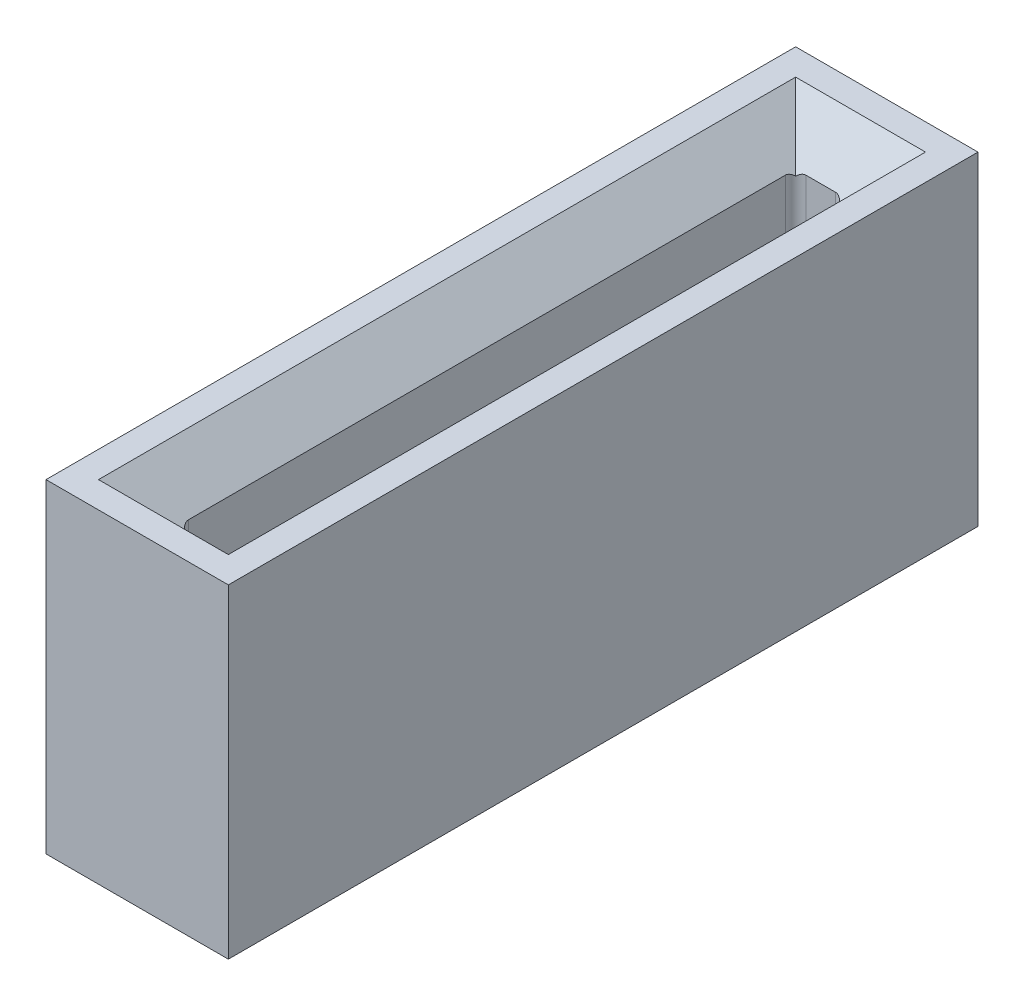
SolidWorks part; units mm, degrees
ref_plane "Front Plane" through (0, 0, 0) normal (1, 0, 0) x (0, 1, 0)
ref_plane "Top Plane" through (0, 0, 0) normal (0, 0, 1) x (0, 1, 0)
ref_plane "Right Plane" through (0, 0, 0) normal (0, 1, 0) x (-1, 0, 0)
sketch "sk 30x2in w weld" plane through (0, 0, 0) normal (0, 1, 0) x (-1, 0, 0)
  line L0 (-92.075, 447.675) -> (92.075, 447.675)
  line L1 (-25.4, 381) -> (25.4, 381)
  line L2 (-25.4, 381) -> (-25.4, -381)
  line L3 (-25.4, -381) -> (25.4, -381)
  line L4 (25.4, 381) -> (25.4, -381)
  line L5 (-25.4, 381) -> (25.4, -381) construction
  line L6 (-25.4, -381) -> (25.4, 381) construction
  line L7 (92.075, 447.675) -> (92.075, -447.675)
  line L8 (-92.075, -447.675) -> (92.075, -447.675)
  line L9 (-92.075, 447.675) -> (-92.075, -447.675)
  point P0 (0, 0)
  dimension "D1" = 50.8
  dimension "D2" = 762
  dimension "D3" = 66.675
sketch "sk block" plane through (0, 0, 0) normal (0, 1, 0) x (-1, 0, 0)
  line L8 (-31.4, 387) -> (-31.4, -387)
  line L9 (-31.4, -387) -> (31.4, -387)
  line L10 (31.4, -387) -> (31.4, 387)
  line L11 (31.4, 387) -> (-31.4, 387)
  line L12 (-31.4, 387) -> (-31.4, -387)
  line L13 (-31.4, -387) -> (31.4, -387)
  line L14 (31.4, -387) -> (31.4, 387)
  line L15 (31.4, 387) -> (-31.4, 387)
  line L20 (-114.3, 469.9) -> (-114.3, -469.9)
  line L21 (-114.3, -469.9) -> (114.3, -469.9)
  line L22 (114.3, -469.9) -> (114.3, 469.9)
  line L23 (114.3, 469.9) -> (-114.3, 469.9)
  line L24 (-114.3, 469.9) -> (-114.3, -469.9)
  line L25 (-114.3, -469.9) -> (114.3, -469.9)
  line L26 (114.3, -469.9) -> (114.3, 469.9)
  line L27 (114.3, 469.9) -> (-114.3, 469.9)
  dimension "D1" = 6
  dimension "D2" = 88.9
sketch "sk Holes" plane through (0, 0, 0) normal (0, 1, 0) x (-1, 0, 0)
  line L0 (-25.4, 381) -> (25.4, 381) construction
  line L1 (-25.4, -381) -> (25.4, -381) construction
  line L2 (-25.4, 381) -> (-25.4, -381) construction
  circle A0 centre (-127, 323.85) radius 19.05
  circle A1 centre (127, 323.85) radius 19.05
  circle A2 centre (-127, -323.85) radius 19.05
  circle A3 centre (127, -323.85) radius 19.05
  circle A4 centre (-127, 213.85) radius 19.05
  circle A5 centre (127, 213.85) radius 19.05
  circle A6 centre (-127, -213.85) radius 19.05
  circle A7 centre (127, -213.85) radius 19.05
  circle A8 centre (-127, 323.85) radius 41.275 construction
  circle A9 centre (127, 323.85) radius 41.275 construction
  circle A10 centre (-127, 103.85) radius 19.05
  circle A11 centre (127, 103.85) radius 19.05
  circle A12 centre (-127, -103.85) radius 19.05
  circle A13 centre (127, -103.85) radius 19.05
  circle A14 centre (-127, 213.85) radius 34.925 construction
  point P10 (0, 381)
  point P23 (-85.725, 323.85)
  dimension "D1" = 38.1
  dimension "D2" = 38.1
  dimension "D6" = 38.1
  dimension "D7" = 38.1
  dimension "D11" = 82.55
  dimension "D12" = 82.55
  dimension "D13" = 60.325
  dimension "D14" = 69.85
  dimension "D3" = 57.15
  dimension "D4" = 127
  dimension "D5" = 127
  dimension "D8" = 57.15
  dimension "D9" = 3
  dimension "D10" = 3
extrude "Boss-Extrude1" add sketch "sk block" along normal mid plane 406.4
chamfer "Chamfer1" distance 50 angle 45 8 edges at (-31.4, -203.2, 0) (0, -203.2, 387) (0, -203.2, -387) (31.4, -203.2, 0) (0, 203.2, -387) (31.4, 203.2, 0) (0, 203.2, 387) (-31.4, 203.2, 0)
fillet "Fillet1" radius 13 4 edges at (-31.4, 0, 387) (31.4, 0, 387) (31.4, 0, -387) (-31.4, 0, -387)
